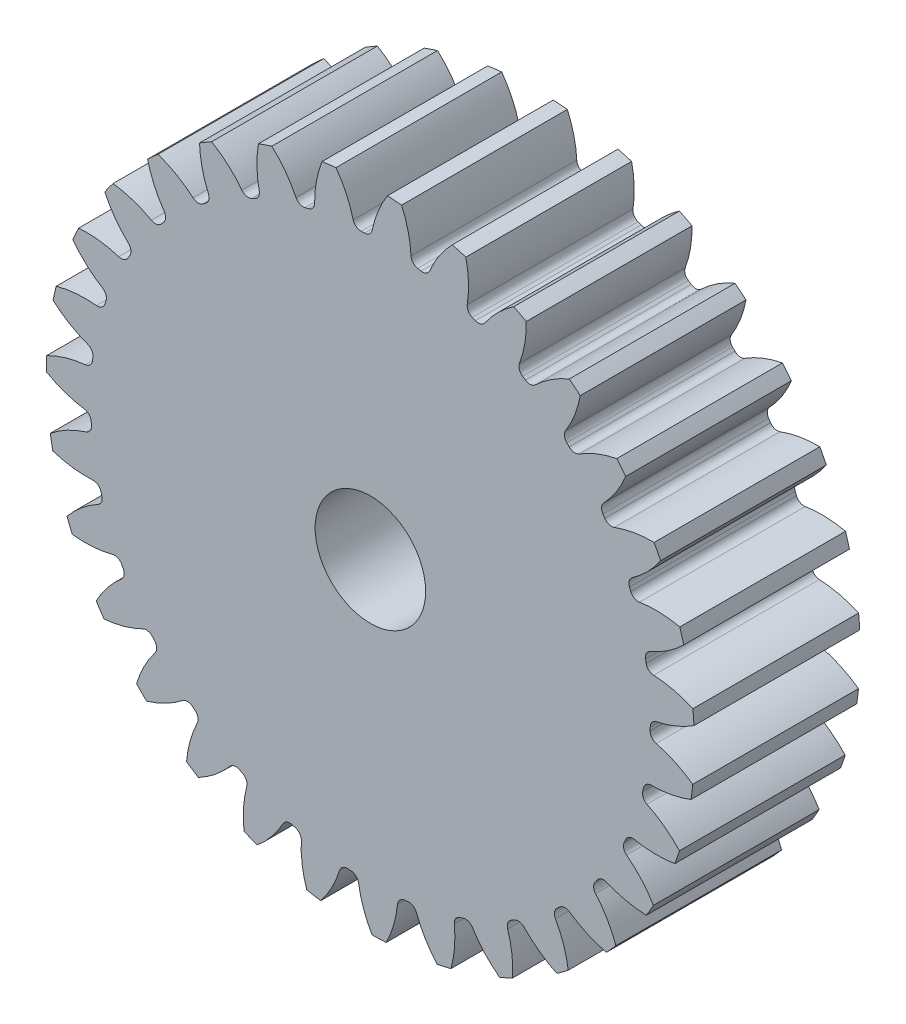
SolidWorks part; units mm, degrees
ref_plane "Front" through (0, 0, 0) normal (0, 0, 1) x (1, 0, 0)
ref_plane "Top" through (0, 0, 0) normal (0, 1, 0) x (1, 0, 0)
ref_plane "Right" through (0, 0, 0) normal (1, 0, 0) x (0, 0, -1)
sketch "Sketch3" plane through (0, 0, 0) normal (0, 0, 1) x (1, 0, 0)
  circle A0 centre (0, 0) radius 186.2667
  dimension "od" = 372.5333
extrude "gearBody" add sketch "Sketch3" along normal blind 95.25
sketch "Sketch2" plane through (0, 0, 0) normal (0, 0, 1) x (1, 0, 0)
  line L0 (0, 0) -> (151.9092, 62.9228) construction
  line L1 (185.5517, -19.4182) -> (0, 0) construction
  line L2 (0, 0) -> (36.3143, 0) construction
  line L3 (174.9157, 4.6615) -> (174.4943, -12.9982) construction
  line L5 (174.705, -4.1684) -> (0, 0) construction
  line L7 (0, 0) -> (164.4253, 0) construction
  arc A0 (164.4181, 1.5452) -> (164.1573, -9.3849) centre (0, 0) ccw construction
  arc A1 (185.9784, 10.3588) -> (185.2727, -19.2167) centre (0, 0) ccw construction
  arc A2 (174.9157, 4.6615) -> (174.4943, -12.9982) centre (0, 0) ccw construction
  arc A3 (160.7945, -4.8192) -> (160.8413, -2.8549) centre (0, 0) ccw
  arc A4 (185.5517, -19.4182) -> (164.2491, -9.4083) centre (148.7354, -70.0961) ccw
  arc A5 (185.5517, -19.4182) -> (186.2667, 10.5468) centre (0, 0) ccw
  arc A6 (186.2667, 10.5468) -> (164.5109, 1.5642) centre (151.9092, 62.9228) cw
  arc A7 (160.8413, -2.8549) -> (164.5109, 1.5642) centre (165.4352, -2.9365) cw
  arc A8 (164.2491, -9.4083) -> (160.7945, -4.8192) centre (165.387, -4.9568) cw
  point P6 (186.2667, 10.5468)
  point P22 (185.5517, -19.4182)
  dimension "baseDia" = 328.8507
  dimension "od" = 372.5333
  dimension "pd" = 349.9556
  dimension "rd" = 321.7333
  dimension "rFillet" = 4.5946
  dimension "pointX" = 186.2667
  dimension "pointY" = 10.5468
  dimension "CTT" = 17.6597
  dimension "flankCenterAngle" = 22.5
extrude "toothCut" cut sketch "Sketch2" along normal through all
pattern_circular "CirPattern1" count 31 over 360 about axis through (0, 0, 0) along (0, 0, 1) of "toothCut"
sketch "hub1Dia" plane through (0, 0, 0) normal (0, 0, -1) x (-1, 0, 0)
  circle A0 centre (0, 0) radius 12.7
  dimension "hub1Dia" = 25.4
sketch "hub2Dia" plane through (0, 0, 95.25) normal (0, 0, 1) x (1, 0, 0)
  circle A0 centre (0, 0) radius 12.7
  dimension "hub2dia" = 25.4
sketch "boreDia" plane through (0, 0, 0) normal (0, 0, 1) x (1, 0, 0)
  circle A0 centre (0, 0) radius 31.75
  dimension "boreDia" = 63.5
extrude "bore" cut sketch "boreDia" against normal mid plane 25400
